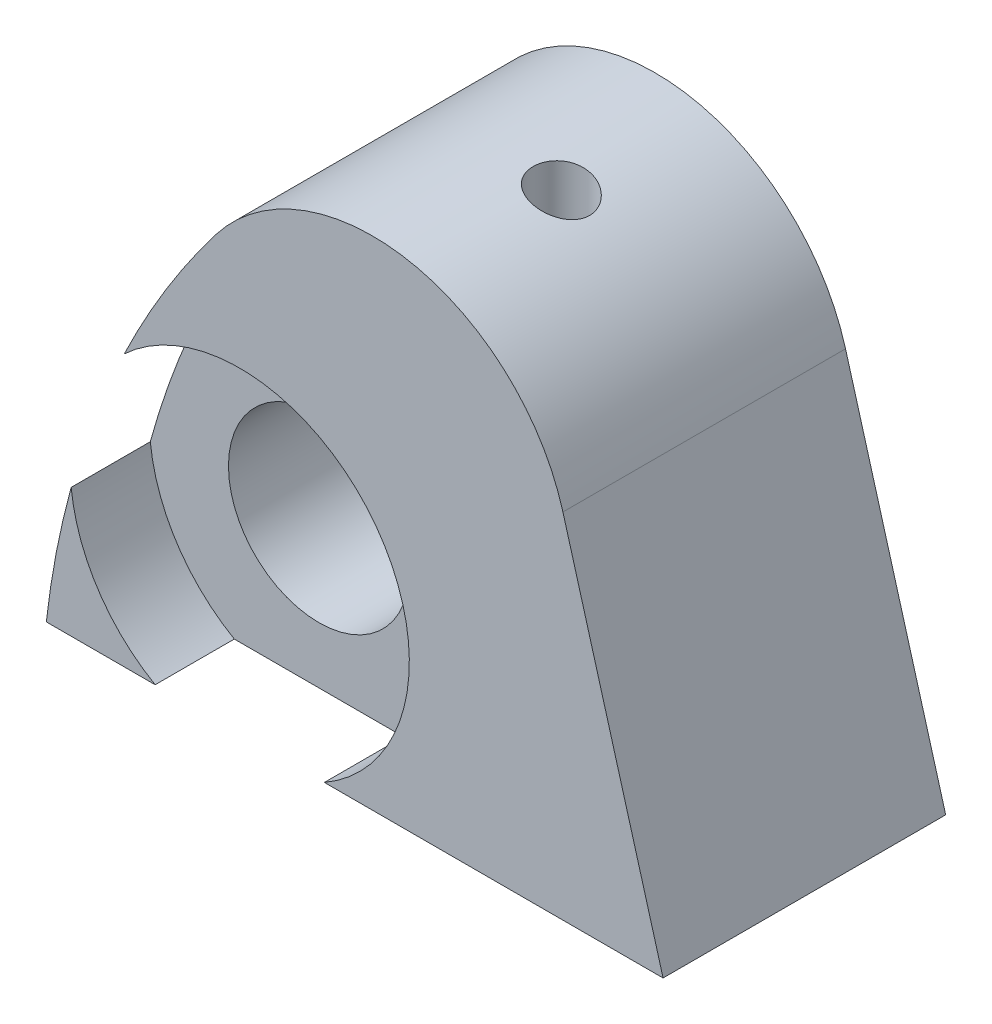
SolidWorks part; units mm, degrees
ref_plane "Face" through (0, 0, 0) normal (0, 0, 1) x (1, 0, 0)
ref_plane "Dessus" through (0, 0, 0) normal (0, 1, 0) x (1, 0, 0)
ref_plane "Droite" through (0, 0, 0) normal (1, 0, 0) x (0, 0, -1)
sketch "Esquisse1" plane through (0, 0, 0) normal (0, 0, 1) x (1, 0, 0)
  line L0 (-5.7727, -5.3) -> (5.1395, -5.3)
  line L1 (3.3674, 0.9542) -> (5.1395, -5.3)
  arc A0 (3.3674, 0.9542) -> (-2.7792, 2.1274) centre (0, 0) ccw
  arc A1 (-2.7792, 2.1274) -> (-5.7727, -5.3) centre (9.1318, -6.99) ccw
  dimension "D1" = 7
  dimension "D4" = 9.1318
  dimension "D6" = 15
  dimension "D2" = 5.3
  dimension "D3" = 74.18
  dimension "D5" = 6.99
extrude "Extrusion1" add sketch "Esquisse1" along normal blind 5
sketch "Esquisse2" plane through (0, 0, 5) normal (0, 0, 1) x (1, 0, 0)
  circle A0 centre (-2.35, -2.7) radius 1.6
  dimension "D3" = 3.2
  dimension "D1" = 2.35
  dimension "D2" = 2.7
extrude "Enlèv. mat.-Extru.1" cut sketch "Esquisse2" against normal through all
sketch "Esquisse3" plane through (0, 0, 5) normal (0, 0, 1) x (1, 0, 0)
  circle A0 centre (-2.35, -2.7) radius 3
  dimension "D1" = 6
extrude "Enlèv. mat.-Extru.2" cut sketch "Esquisse3" against normal blind 1.4
sketch "Esquisse4" plane through (0, 0, 0) normal (0, 0, -1) x (-1, 0, 0)
  circle A0 centre (0, 0) radius 1
  dimension "D1" = 2
extrude "Enlèv. mat.-Extru.3" cut sketch "Esquisse4" against normal blind 1.3
sketch "Esquisse5" plane through (0, -5.3, 0) normal (0, -1, 0) x (1, 0, 0)
  line L0 (5.1395, 5) -> (5.1395, 0) construction
  line L1 (-5.7727, 0) -> (5.1395, 0) construction
  circle A0 centre (0.8395, 2.5) radius 0.5
  dimension "D3" = 1
  dimension "D1" = 4.3
  dimension "D2" = 2.5
extrude "Enlèv. mat.-Extru.4" cut sketch "Esquisse5" against normal through all
sketch "Esquisse6" plane through (0, -5.3, 0) normal (0, -1, 0) x (1, 0, 0)
  circle A0 centre (0.8395, 2.5) radius 1
  dimension "D1" = 2
extrude "Enlèv. mat.-Extru.5" cut sketch "Esquisse6" against normal blind 5
chamfer "Chanfrein1" distance 0.5 angle 45 1 edges at (1.8395, -5.3, 2.5)
